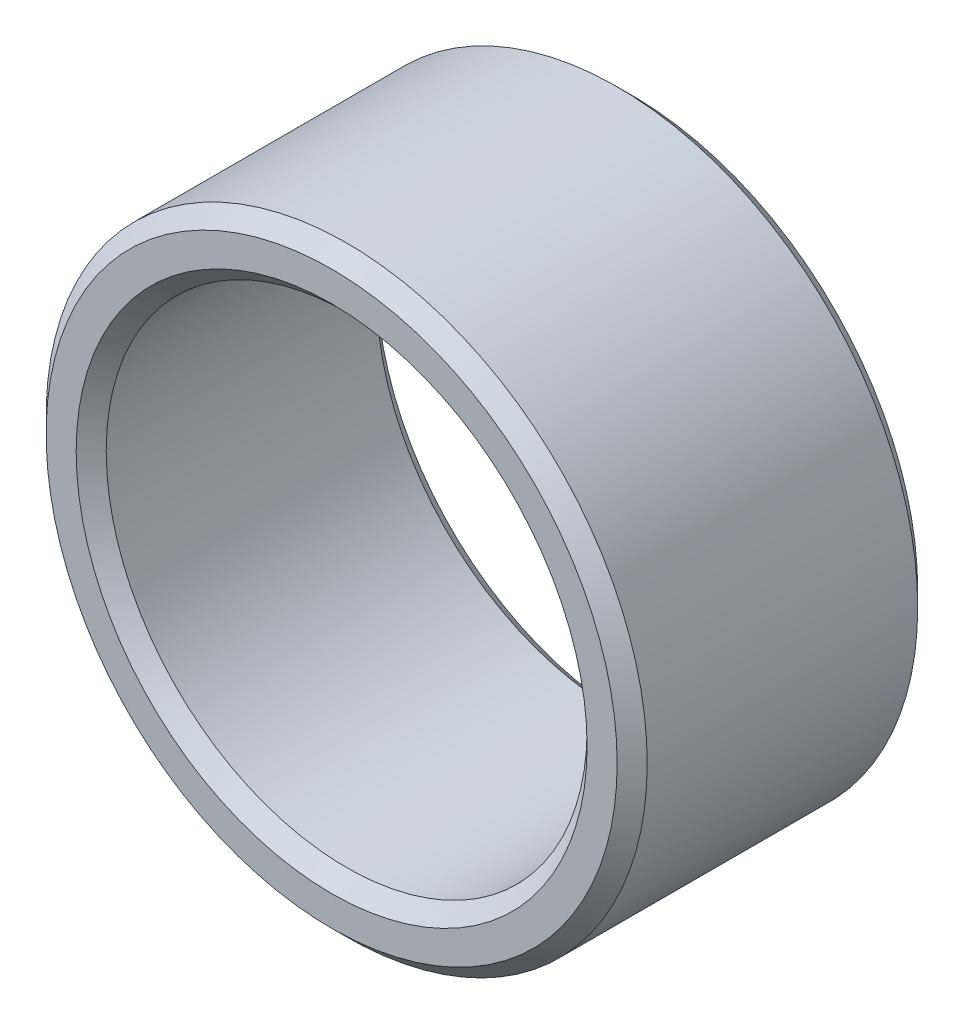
SolidWorks part; units mm, degrees
ref_plane "Face" through (0, 0, 0) normal (0, 0, 1) x (1, 0, 0)
ref_plane "Dessus" through (0, 0, 0) normal (0, 1, 0) x (1, 0, 0)
ref_plane "Droite" through (0, 0, 0) normal (1, 0, 0) x (0, 0, -1)
sketch "Esquisse1" plane through (0, 0, 0) normal (0, 0, 1) x (1, 0, 0)
  circle A0 centre (0, 0) radius 16
  circle A1 centre (0, 0) radius 20
  dimension "D1" = 32
  dimension "D2" = 40
extrude "Boss.-Extru.1" add sketch "Esquisse1" along normal blind 20
chamfer "Chanfrein1" distance 1 angle 45 4 edges at (16, 0, 0) (20, 0, 0) (16, 0, 20) (20, 0, 20)
